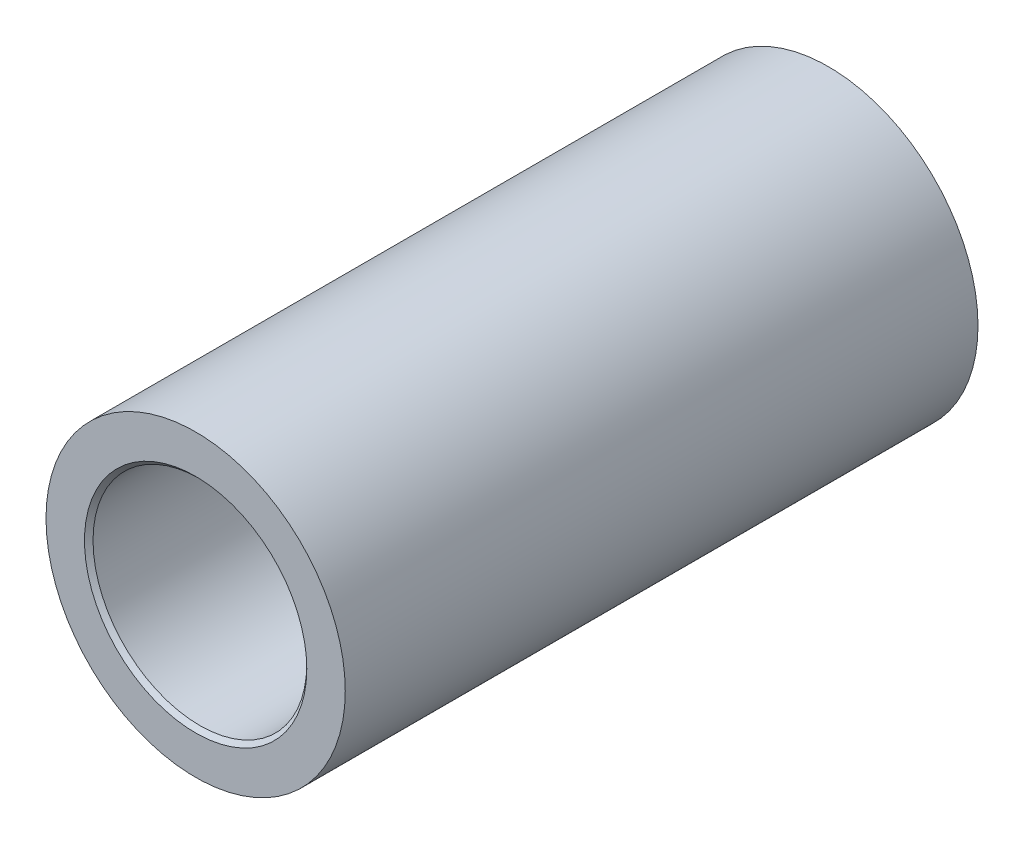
SolidWorks part; units mm, degrees
ref_plane "Plan 1" through (0, 0, 0) normal (0, 0, 1) x (1, 0, 0)
ref_plane "Plan 2" through (0, 0, 0) normal (0, 1, 0) x (1, 0, 0)
ref_plane "Plan 3" through (0, 0, 0) normal (1, 0, 0) x (0, 0, -1)
sketch "Esquisse1" plane through (0, 0, 0) normal (0, 0, 1) x (1, 0, 0)
  circle A0 centre (0, 0) radius 17.5
  circle A1 centre (0, 0) radius 12.5
  dimension "D1" = 35
  dimension "D2" = 25
extrude "Extrusion1" add sketch "Esquisse1" along normal blind 74
chamfer "Chanfrein1" distance 0.5 angle 45 2 edges at (12.5, 0, 0) (12.5, 0, 74)
